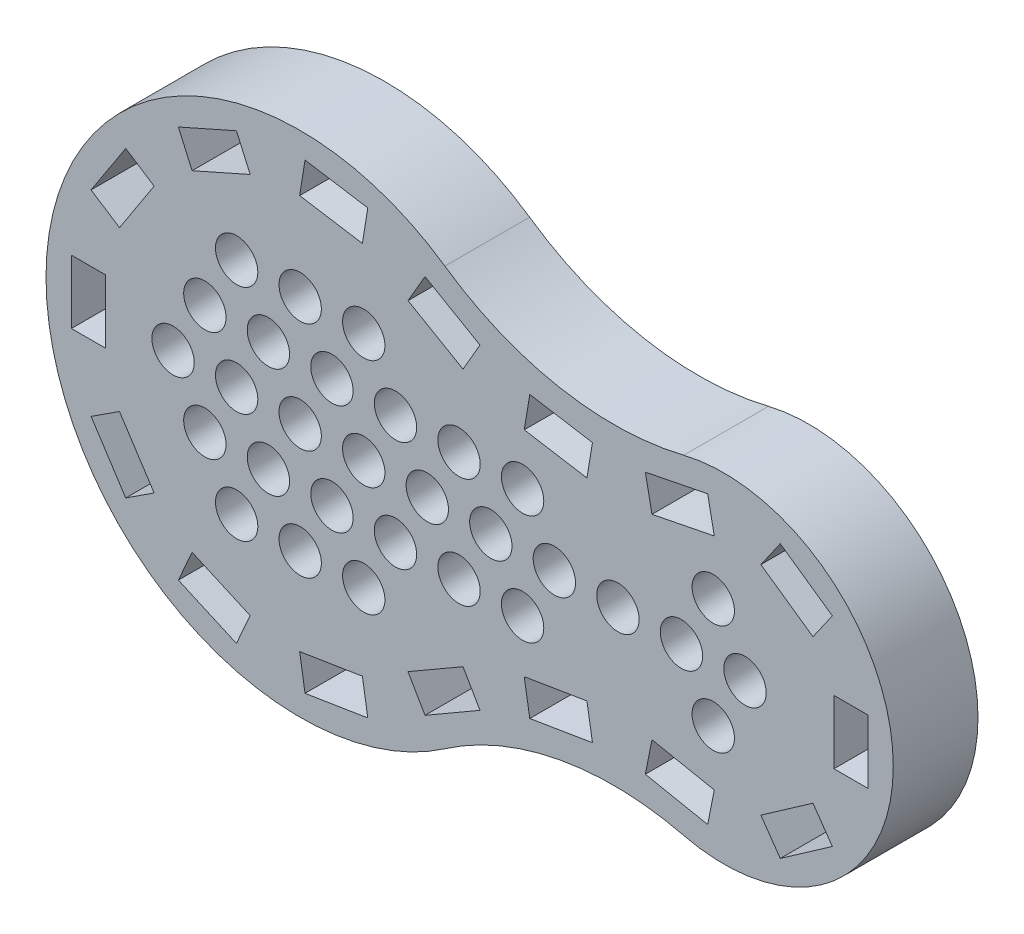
SolidWorks part; units mm, degrees
ref_plane "Płaszczyzna przednia" through (0, 0, 0) normal (0, 0, 1) x (1, 0, 0)
ref_plane "Płaszczyzna górna" through (0, 0, 0) normal (0, 1, 0) x (1, 0, 0)
ref_plane "Płaszczyzna prawa" through (0, 0, 0) normal (1, 0, 0) x (0, 0, -1)
sketch "Szkic1" plane through (0, 0, 0) normal (0, 0, 1) x (1, 0, 0)
  arc A0 (34.1538, 49.3307) -> (34.1538, -49.3307) centre (0, 0) ccw
  arc A1 (90.5455, -38.8666) -> (90.5455, 38.8666) centre (100, 0) ccw
  arc A2 (34.1538, 49.3307) -> (90.5455, 38.8666) centre (74, 106.8831) ccw
  arc A3 (90.5455, -38.8666) -> (34.1538, -49.3307) centre (74, -106.8831) ccw
  point P4 (0, 0)
  dimension "D2" = 60
  dimension "D3" = 40
  dimension "D4" = 70
  dimension "D1" = 100
extrude "Dodanie-wyciągnięcie1" add sketch "Szkic1" along normal blind 20
sketch "Szkic2" plane through (0, 0, 20) normal (0, 0, 1) x (1, 0, 0)
  arc A8 (92.9091, -29.1499) -> (28.4615, -41.1089) centre (74, -106.8831) ccw
  arc A9 (92.9091, -29.1499) -> (92.9091, 29.1499) centre (100, 0) ccw
  arc A10 (28.4615, 41.1089) -> (92.9091, 29.1499) centre (74, 106.8831) ccw
  arc A11 (28.4615, 41.1089) -> (28.4615, -41.1089) centre (0, 0) ccw
  arc A12 (92.9091, -29.1499) -> (28.4615, -41.1089) centre (74, -106.8831) ccw
  arc A13 (92.9091, -29.1499) -> (92.9091, 29.1499) centre (100, 0) ccw
  arc A14 (28.4615, 41.1089) -> (92.9091, 29.1499) centre (74, 106.8831) ccw
  arc A15 (28.4615, 41.1089) -> (28.4615, -41.1089) centre (0, 0) ccw
  dimension "D1" = 10
sketch "Szkic3" plane through (0, 0, 20) normal (0, 0, 1) x (1, 0, 0)
  line L1 (-54, -7.5) -> (-46, -7.5)
  line L2 (-54, -7.5) -> (-54, 7.5)
  line L3 (-54, 7.5) -> (-46, 7.5)
  line L4 (-46, -7.5) -> (-46, 7.5)
  line L5 (-54, -7.5) -> (-46, 7.5) construction
  line L6 (-54, 7.5) -> (-46, -7.5) construction
  arc A0 (28.4615, 41.1089) -> (28.4615, -41.1089) centre (0, 0) ccw construction
  point P0 (-50, 0)
  dimension "D1" = 8
  dimension "D2" = 15
extrude "Wytnij-wyciągnięcie1" cut sketch "Szkic3" against normal through all
pattern_curve "CrvPattern1" of "Wytnij-wyciągnięcie1" parameters "D1"=16, "D3"=10, "D2"=1, "D4"=10
sketch "Szkic5" plane through (0, 0, 20) normal (0, 0, 1) x (1, 0, 0)
  line L0 (0, 0) -> (83.7783, 0) construction
  arc A8 (95.2727, -19.4333) -> (22.7692, -32.8871) centre (74, -106.8831) ccw
  arc A9 (95.2727, -19.4333) -> (95.2727, 19.4333) centre (100, 0) ccw
  arc A10 (22.7692, 32.8871) -> (95.2727, 19.4333) centre (74, 106.8831) ccw
  arc A11 (22.7692, 32.8871) -> (22.7692, -32.8871) centre (0, 0) ccw
  arc A12 (95.2727, -19.4333) -> (22.7692, -32.8871) centre (74, -106.8831) ccw
  arc A13 (95.2727, -19.4333) -> (95.2727, 19.4333) centre (100, 0) ccw
  arc A14 (22.7692, 32.8871) -> (95.2727, 19.4333) centre (74, 106.8831) ccw
  arc A15 (22.7692, 32.8871) -> (22.7692, -32.8871) centre (0, 0) ccw
  dimension "D1" = 20
sketch "Szkic6" plane through (0, 0, 20) normal (0, 0, 1) x (1, 0, 0)
  circle A0 centre (-30, 0) radius 5
  point P2 (0, 0)
  dimension "D1" = 10
  dimension "D2" = 30
extrude "Wytnij-wyciągnięcie2" cut sketch "Szkic6" against normal through all
other "Wzór wypełnienia1" parameters "D5"=0, "D6"=0, "D1"=15, "D2"=60, "D3"=0, "D9"=30, "D7"=15, "D8"=6
